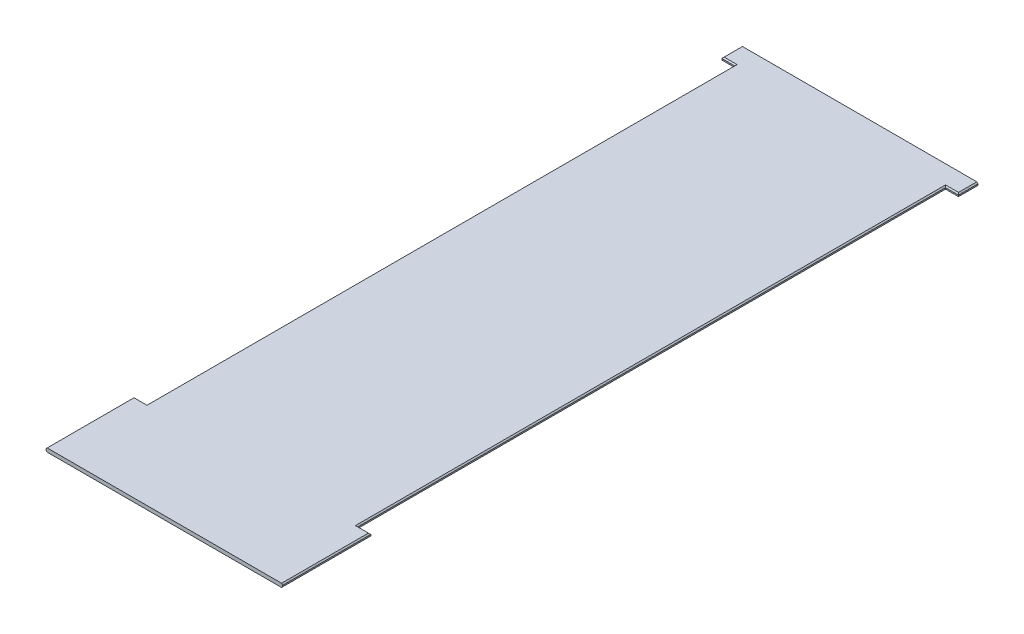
SolidWorks part; units mm, degrees
ref_plane "Front Plane" through (0, 0, 0) normal (1, 0, 0) x (0, 1, 0)
ref_plane "Top Plane" through (0, 0, 0) normal (0, 0, 1) x (0, 1, 0)
ref_plane "Right Plane" through (0, 0, 0) normal (0, 1, 0) x (-1, 0, 0)
sketch "Sketch2"
sketch_block_instance "Block5-1"
sketch_block "Block5" parameters "D1"=79.2, "D2"=79.2
extrude "Boss-Extrude2" add sketch "Sketch2" along normal mid plane 19.05
chamfer "Chamfer1" distance 6 angle 45 32 edges at (486.7616, 0, -1445.0719) (520.0116, 9.525, -1445.0719) (520.0116, -9.525, -1445.0719) (553.2616, 0, -1445.0719) (553.2616, 9.525, -1495.0719) (553.2616, 0, -1545.0719) (553.2616, -9.525, -1495.0719) (486.7616, 9.525, 60.9281) (486.7616, -9.525, 60.9281) (520.0116, 9.525, 1566.9281) (486.7616, 0, 1566.9281) (520.0116, -9.525, 1566.9281) (553.2616, 0, 2018.1281) (553.2616, 9.525, 1792.5281) (553.2616, 0, 1566.9281) (553.2616, -9.525, 1792.5281) (-659.9384, 0, 1566.9281) (-659.9384, 9.525, 1792.5281) (-659.9384, 0, 2018.1281) (-659.9384, -9.525, 1792.5281) (-626.6884, 9.525, 1566.9281) (-626.6884, -9.525, 1566.9281) (-593.4384, 9.525, 60.9281) (-593.4384, 0, 1566.9281) (-593.4384, -9.525, 60.9281) (-626.6884, 9.525, -1445.0719) (-593.4384, 0, -1445.0719) (-626.6884, -9.525, -1445.0719) (-659.9384, 0, -1545.0719) (-659.9384, 9.525, -1495.0719) (-659.9384, 0, -1445.0719) (-659.9384, -9.525, -1495.0719)
